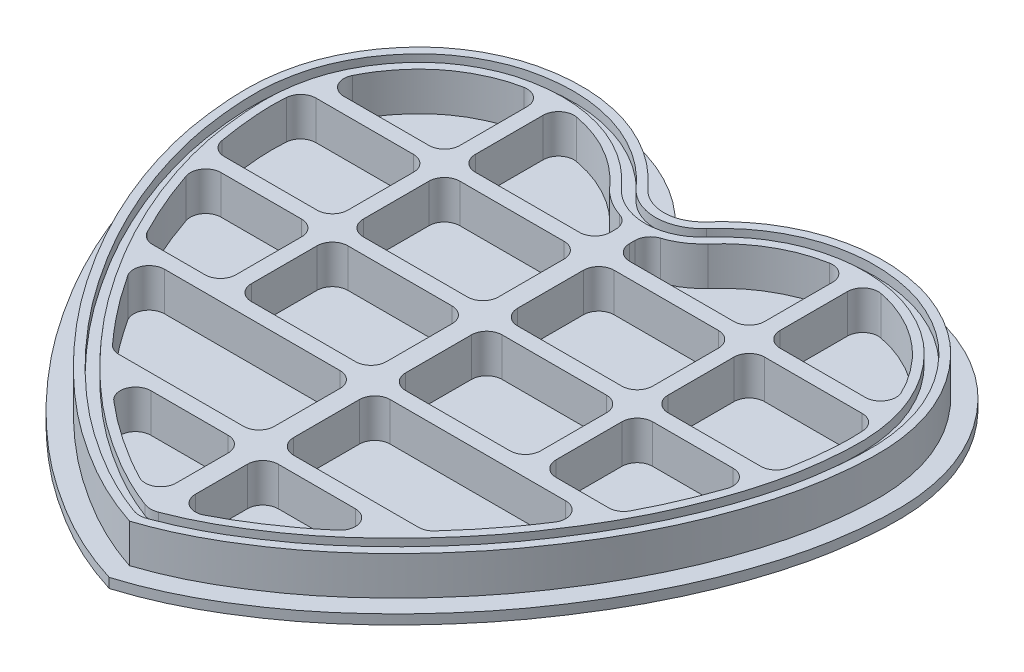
SolidWorks part; units mm, degrees
ref_plane "Front Plane" through (0, 0, 0) normal (0, 0, 1) x (1, 0, 0)
ref_plane "Top Plane" through (0, 0, 0) normal (0, 1, 0) x (1, 0, 0)
ref_plane "Right Plane" through (0, 0, 0) normal (1, 0, 0) x (0, 0, -1)
sketch "Sketch1" plane through (0, 0, 0) normal (0, 1, 0) x (1, 0, 0)
  arc A0 (-4.7475, 190.8725) -> (4.7475, 190.8725) centre (0, 195.0896) ccw
  spline S0 degree 3 poles (0, 0) (-6.9704, 2.1411) (-17.3052, 6.5092) (-30.2851, 14.3663) (-40.1508, 21.1835) (-49.6034, 29.0743) (-58.743, 37.7359) (-67.3785, 47.1382) (-75.5752, 57.1133) (-82.955, 67.7484) (-89.7919, 78.7217) (-95.738, 90.1158) (-100.8249, 101.7554) (-104.934, 113.6029) (-108.0334, 125.5149) (-109.7563, 137.4697) (-110.4471, 147.5565) (-110.0632, 155.7161) (-109.1075, 161.8984) (-107.688, 167.8632) (-105.6136, 173.5598) (-103.0387, 178.9712) (-99.994, 184.084) (-96.4904, 188.8114) (-92.6277, 193.2321) (-88.3533, 197.2568) (-83.6456, 200.8156) (-78.6368, 203.9332) (-73.2922, 206.5079) (-67.7257, 208.658) (-61.8582, 210.0699) (-55.8523, 211.0164) (-49.2375, 211.3688) (-42.1783, 210.9497) (-34.8451, 209.5327) (-27.8211, 207.308) (-21.2163, 204.1683) (-15.0288, 200.3457) (-9.5539, 195.8446) (-6.2412, 192.5542) (-4.7475, 190.8725) knots 0 0 0 0 0.062261 0.09531 0.129472 0.164592 0.200365 0.236953 0.273568 0.310548 0.347436 0.383933 0.420222 0.455837 0.490947 0.525167 0.558872 0.577133 0.594814 0.612233 0.62942 0.646491 0.663354 0.680162 0.696681 0.71344 0.73021 0.74701 0.763743 0.780818 0.797872 0.815181 0.832691 0.854352 0.875406 0.896334 0.917108 0.937714 0.958297 0.977512 0.977512 0.977512 0.977512
  spline S1 degree 3 poles (0, 0) (6.9704, 2.1411) (17.3052, 6.5092) (30.2851, 14.3663) (40.1508, 21.1835) (49.6034, 29.0743) (58.743, 37.7359) (67.3785, 47.1382) (75.5752, 57.1133) (82.955, 67.7484) (89.7919, 78.7217) (95.738, 90.1158) (100.8249, 101.7554) (104.934, 113.6029) (108.0334, 125.5149) (109.7563, 137.4697) (110.4471, 147.5565) (110.0632, 155.7161) (109.1075, 161.8984) (107.688, 167.8632) (105.6136, 173.5598) (103.0387, 178.9712) (99.994, 184.084) (96.4904, 188.8114) (92.6277, 193.2321) (88.3533, 197.2568) (83.6456, 200.8156) (78.6368, 203.9332) (73.2922, 206.5079) (67.7257, 208.658) (61.8582, 210.0699) (55.8523, 211.0164) (49.2375, 211.3688) (42.1783, 210.9497) (34.8451, 209.5327) (27.8211, 207.308) (21.2163, 204.1683) (15.0288, 200.3457) (9.5539, 195.8446) (6.2412, 192.5542) (4.7475, 190.8725) knots 0 0 0 0 0.062261 0.09531 0.129472 0.164592 0.200365 0.236953 0.273568 0.310548 0.347436 0.383933 0.420222 0.455837 0.490947 0.525167 0.558872 0.577133 0.594814 0.612233 0.62942 0.646491 0.663354 0.680162 0.696681 0.71344 0.73021 0.74701 0.763743 0.780818 0.797872 0.815181 0.832691 0.854352 0.875406 0.896334 0.917108 0.937714 0.958297 0.977512 0.977512 0.977512 0.977512
  dimension "D1" = 6.35
extrude "Boss-Extrude1" add sketch "Sketch1" along normal blind 3.175
sketch "Sketch4" plane through (0, 3.175, 0) normal (0, 1, 0) x (1, 0, 0)
  arc A1 (-9.495, 186.6555) -> (9.495, 186.6555) centre (0, 195.0896) ccw
  arc A2 (-9.495, 186.6555) -> (9.495, 186.6555) centre (0, 195.0896) ccw
  spline S4 degree 3 number of poles 122 (-9.495, 186.6555) -> (0, 6.6626)
  spline S5 degree 3 number of poles 124 (0, 6.6626) -> (9.495, 186.6555)
  spline S6 degree 3 number of poles 122 (-9.495, 186.6555) -> (0, 6.6626)
  spline S7 degree 3 number of poles 124 (0, 6.6626) -> (9.495, 186.6555)
  dimension "D1" = 6.35
extrude "Boss-Extrude3" add sketch "Sketch4" along normal blind 12.7
sketch "Sketch5" plane through (0, 15.875, 0) normal (0, 1, 0) x (1, 0, 0)
  line L1 (-3.175, 162.9059) -> (-3.175, 173.7344)
  line L2 (3.175, 162.9059) -> (3.175, 173.7344)
  line L3 (-93.1372, 162.9059) -> (-52.6696, 162.9059)
  line L4 (52.6696, 162.9059) -> (93.137, 162.9059)
  line L5 (-94.2805, 157.8259) -> (-52.6696, 157.8259)
  line L6 (3.175, 162.9059) -> (47.5896, 162.9059)
  line L7 (-92.3343, 126.0759) -> (-52.6696, 126.0759)
  line L8 (-47.5896, 162.9059) -> (-3.175, 162.9059)
  line L9 (-141.8606, 126.0759) -> (144.7018, 126.0759)
  line L10 (-141.8606, 157.8259) -> (144.7018, 157.8259)
  line L13 (-141.8606, 89.2459) -> (144.7018, 89.2459)
  line L14 (-141.8606, 120.9959) -> (144.7018, 120.9959)
  line L17 (-141.8606, 52.4159) -> (144.7018, 52.4159)
  line L18 (-141.8606, 84.1659) -> (144.7018, 84.1659)
  line L21 (-141.8606, 15.5859) -> (144.7018, 15.5859)
  line L22 (-141.8606, 47.3359) -> (144.7018, 47.3359)
  line L24 (-3.175, 17.2878) -> (-3.175, 47.3359)
  line L25 (-78.0235, 89.2459) -> (-52.6696, 89.2459)
  line L26 (-91.0427, 120.9959) -> (-52.6696, 120.9959)
  line L27 (3.175, 157.8259) -> (47.5896, 157.8259)
  line L28 (3.175, 17.2878) -> (3.175, 47.3359)
  line L29 (-51.4861, 52.4159) -> (-3.175, 52.4159)
  line L30 (-75.137, 84.1659) -> (-3.175, 84.1659)
  line L31 (-52.6696, 236.659) -> (-47.5896, 236.659)
  line L32 (3.175, 84.1659) -> (75.137, 84.1659)
  line L33 (3.175, 126.0759) -> (3.175, 157.8259)
  line L34 (-46.5896, 47.3359) -> (-3.175, 47.3359)
  line L35 (-3.175, 89.2459) -> (-3.175, 120.9959)
  line L37 (-8.843, 15.5859) -> (8.8433, 15.5859)
  line L38 (-52.6696, 195.8923) -> (-52.6696, 162.9059)
  line L39 (-3.175, 126.0759) -> (-3.175, 157.8259)
  line L40 (3.175, 126.0759) -> (47.5896, 126.0759)
  line L41 (3.175, 120.9959) -> (47.5896, 120.9959)
  line L42 (3.175, 89.2459) -> (47.5896, 89.2459)
  line L43 (3.175, 89.2459) -> (3.175, 120.9959)
  line L44 (3.175, 52.4159) -> (51.4862, 52.4159)
  line L45 (3.175, 47.3359) -> (46.5896, 47.3359)
  line L46 (-3.175, 52.4159) -> (-3.175, 84.1659)
  line L47 (3.175, 52.4159) -> (3.175, 84.1659)
  line L48 (52.6696, 157.8259) -> (94.2806, 157.8259)
  line L49 (-47.5896, 195.9577) -> (-47.5896, 162.9059)
  line L50 (-47.5896, 126.0759) -> (-3.175, 126.0759)
  line L52 (-52.6696, 120.9959) -> (-52.6696, 89.2459)
  line L53 (-47.5896, 120.9959) -> (-47.5896, 89.2459)
  line L54 (52.6696, 126.0759) -> (92.3343, 126.0759)
  line L55 (-47.5896, 157.8259) -> (-3.175, 157.8259)
  line L56 (-47.5896, 157.8259) -> (-47.5896, 126.0759)
  line L57 (-52.6696, 157.8259) -> (-52.6696, 126.0759)
  line L58 (-47.5896, 120.9959) -> (-3.175, 120.9959)
  line L59 (-47.5896, 89.2459) -> (-3.175, 89.2459)
  line L60 (47.5896, 195.9577) -> (47.5896, 126.0759)
  line L62 (52.6696, 195.8924) -> (52.6696, 126.0759)
  line L63 (52.6696, 120.9959) -> (91.0427, 120.9959)
  line L66 (47.5896, 120.9959) -> (47.5896, 89.2459)
  line L67 (52.6696, 120.9959) -> (52.6696, 89.2459)
  line L68 (52.6696, 89.2459) -> (78.0235, 89.2459)
  arc A1 (3.175, 173.7344) -> (16.1414, 180.7515) centre (0, 195.0896) ccw
  arc A6 (-16.1414, 180.7515) -> (16.1414, 180.7515) centre (0, 195.0896) ccw
  arc A7 (-16.1414, 180.7515) -> (-3.175, 173.7344) centre (0, 195.0896) ccw
  spline S0 degree 3 poles (47.5896, 195.9577) (47.4876, 195.9532) (47.3856, 195.9484) (46.5397, 195.9059) (45.7926, 195.8493) (44.3115, 195.6978) (43.5761, 195.6024) (41.3849, 195.2613) (39.9436, 194.961) (37.0959, 194.2297) (35.6892, 193.7996) (33.611, 193.0359) (32.9238, 192.7608) (31.5601, 192.1702) (30.8819, 191.8543) (28.8739, 190.8589) (27.5742, 190.1394) (25.6855, 188.973) (25.0664, 188.5692) (23.8519, 187.7276) (23.2569, 187.2892) (21.5048, 185.9269) (20.3789, 184.9583) (18.1913, 182.929) (17.1344, 181.8693) (16.1414, 180.7515) knots 0.873928 0.873928 0.873928 0.873928 0.875 0.875 0.882812 0.882812 0.890625 0.890625 0.90625 0.90625 0.921875 0.921875 0.929687 0.929687 0.9375 0.9375 0.953125 0.953125 0.960937 0.960937 0.96875 0.96875 0.984375 0.984375 1 1 1 1
  spline S1 degree 3 poles (93.137, 162.9059) (93.0147, 163.3366) (92.8856, 163.7639) (92.5235, 164.8889) (92.2788, 165.5808) (91.4957, 167.6324) (90.9106, 168.9692) (89.625, 171.5861) (88.9248, 172.8663) (87.3985, 175.3649) (86.5683, 176.5813) (85.2315, 178.3609) (84.7735, 178.9447) (83.8387, 180.0894) (83.3609, 180.6508) (81.8939, 182.3001) (80.8705, 183.3521) (78.7152, 185.3425) (77.581, 186.2786) (75.2083, 188.0416) (73.9688, 188.8772) (72.0724, 190.0241) (71.4324, 190.3887) (70.136, 191.0801) (69.4798, 191.4079) (68.1545, 192.0339) (67.4855, 192.3325) (66.1364, 192.9045) (65.4559, 193.1771) (64.0783, 193.6844) (63.3808, 193.9181) (61.9637, 194.3357) (61.2448, 194.5212) (59.7924, 194.8586) (59.0626, 195.0102) (57.6029, 195.2858) (56.8719, 195.4095) (54.9864, 195.6854) (53.8298, 195.8117) (52.6696, 195.8924) knots 0.659341 0.659341 0.659341 0.659341 0.664062 0.664062 0.671875 0.671875 0.6875 0.6875 0.703125 0.703125 0.71875 0.71875 0.726562 0.726562 0.734375 0.734375 0.75 0.75 0.765625 0.765625 0.78125 0.78125 0.789062 0.789062 0.796875 0.796875 0.804687 0.804687 0.8125 0.8125 0.820312 0.820312 0.828125 0.828125 0.835937 0.835937 0.84375 0.84375 0.856053 0.856053 0.856053 0.856053
  spline S3 degree 3 poles (51.4862, 52.4159) (53.037, 54.0896) (54.558, 55.792) (57.9625, 59.7266) (59.8302, 61.9741) (62.5419, 65.4315) (63.4303, 66.5987) (65.1754, 68.9638) (66.0325, 70.1611) (67.721, 72.5803) (68.5519, 73.8016) (70.1859, 76.2535) (70.9904, 77.4853) (72.9319, 80.5225) (74.0526, 82.3356) (75.137, 84.1659) knots 0.225541 0.225541 0.225541 0.225541 0.25 0.25 0.28125 0.28125 0.296875 0.296875 0.3125 0.3125 0.328125 0.328125 0.34375 0.34375 0.366455 0.366455 0.366455 0.366455
  spline S4 degree 3 poles (-75.137, 84.1659) (-74.0404, 82.3151) (-72.9069, 80.4821) (-70.9511, 77.4248) (-70.1456, 76.1924) (-68.5099, 73.7394) (-67.6786, 72.5185) (-65.1479, 68.8962) (-63.4066, 66.5321) (-59.7922, 61.9275) (-57.9247, 59.6816) (-54.5325, 55.7636) (-53.0242, 54.0758) (-51.4861, 52.4159) knots 0.633313 0.633313 0.633313 0.633313 0.65625 0.65625 0.671875 0.671875 0.6875 0.6875 0.71875 0.71875 0.75 0.75 0.774254 0.774254 0.774254 0.774254
  spline S5 degree 3 poles (-46.5896, 47.3359) (-45.7271, 46.4767) (-44.8553, 45.6263) (-41.8618, 42.7686) (-39.6973, 40.8013) (-35.2601, 36.9682) (-32.9822, 35.1054) (-28.271, 31.5334) (-25.8603, 29.845) (-22.1874, 27.4132) (-20.9542, 26.6183) (-18.4681, 25.0637) (-17.2146, 24.3048) (-14.6812, 22.8339) (-13.4011, 22.1222) (-10.8085, 20.7561) (-9.4965, 20.101) (-6.5289, 18.7013) (-4.8648, 17.9717) (-3.175, 17.2878) knots 0.79946 0.79946 0.79946 0.79946 0.8125 0.8125 0.84375 0.84375 0.875 0.875 0.90625 0.90625 0.921875 0.921875 0.9375 0.9375 0.953125 0.953125 0.96875 0.96875 0.988036 0.988036 0.988036 0.988036
  spline S6 degree 3 poles (78.0235, 89.2459) (78.8709, 90.8037) (79.6912, 92.3744) (81.7938, 96.5641) (83.0343, 99.203) (86.5406, 107.2219) (88.5802, 112.7093) (90.542, 119.2338) (90.797, 120.1127) (91.0427, 120.9959) knots 0.387272 0.387272 0.387272 0.387272 0.40625 0.40625 0.4375 0.4375 0.5 0.5 0.50968 0.50968 0.50968 0.50968
  spline S7 degree 3 poles (-91.0427, 120.9959) (-90.7976, 120.1152) (-90.5427, 119.2363) (-88.5765, 112.6964) (-86.5312, 107.1972) (-83.0167, 99.1644) (-81.7735, 96.5216) (-79.6752, 92.3438) (-78.8626, 90.7885) (-78.0235, 89.2459) knots 0.490345 0.490345 0.490345 0.490345 0.5 0.5 0.5625 0.5625 0.59375 0.59375 0.612518 0.612518 0.612518 0.612518
  spline S8 degree 3 poles (92.3343, 126.0759) (92.4008, 126.3663) (92.466, 126.657) (93.1646, 129.8372) (93.6589, 132.7486) (94.2407, 137.1407) (94.4096, 138.6086) (94.7006, 141.5518) (94.8216, 143.0281) (94.991, 145.9887) (95.0388, 147.4658) (95.0349, 150.4117) (94.9831, 151.8805) (94.7439, 154.8065) (94.5519, 156.2634) (94.2935, 157.752) (94.287, 157.789) (94.2806, 157.8259) knots 0.528104 0.528104 0.528104 0.528104 0.53125 0.53125 0.5625 0.5625 0.578125 0.578125 0.59375 0.59375 0.609375 0.609375 0.625 0.625 0.640625 0.640625 0.641022 0.641022 0.641022 0.641022
  spline S10 degree 3 poles (-52.6696, 195.8923) (-53.8064, 195.8133) (-54.9414, 195.6903) (-56.8083, 195.4198) (-57.5414, 195.2966) (-59.0063, 195.0216) (-59.7378, 194.8703) (-61.1847, 194.5362) (-61.9015, 194.3524) (-63.3165, 193.9386) (-64.014, 193.7066) (-65.3926, 193.2017) (-66.0742, 192.9299) (-67.4262, 192.3585) (-68.097, 192.06) (-69.427, 191.4337) (-70.086, 191.1057) (-71.3894, 190.4127) (-72.0333, 190.0469) (-73.3065, 189.2786) (-73.9361, 188.8767) (-75.1684, 188.0488) (-75.7728, 187.6215) (-77.5521, 186.3014) (-78.6889, 185.3654) (-80.8533, 183.3694) (-81.8833, 182.3123) (-83.361, 180.6504) (-83.8431, 180.0832) (-84.7851, 178.9297) (-85.2435, 178.3455) (-86.5772, 176.5683) (-87.4089, 175.3495) (-88.9428, 172.8352) (-89.649, 171.5421) (-90.623, 169.5519) (-90.9332, 168.8799) (-91.5239, 167.5184) (-91.8054, 166.8271) (-92.3314, 165.4354) (-92.5756, 164.7358) (-92.9177, 163.6578) (-93.0302, 163.2824) (-93.1372, 162.9059) knots 0.144186 0.144186 0.144186 0.144186 0.15625 0.15625 0.164062 0.164062 0.171875 0.171875 0.179687 0.179687 0.1875 0.1875 0.195312 0.195312 0.203125 0.203125 0.210937 0.210937 0.21875 0.21875 0.226562 0.226562 0.234375 0.234375 0.25 0.25 0.265625 0.265625 0.273437 0.273437 0.28125 0.28125 0.296875 0.296875 0.3125 0.3125 0.320313 0.320313 0.328125 0.328125 0.335938 0.335938 0.340092 0.340092 0.340092 0.340092
  spline S14 degree 3 poles (-94.2805, 157.8259) (-94.2937, 157.751) (-94.3067, 157.6762) (-94.5676, 156.1545) (-94.7574, 154.6961) (-94.9901, 151.7501) (-95.0386, 150.2585) (-95.0361, 147.2985) (-94.9847, 145.8255) (-94.8111, 142.8893) (-94.6894, 141.4261) (-94.3982, 138.5064) (-94.2296, 137.0498) (-93.6492, 132.6902) (-93.1568, 129.7987) (-92.4628, 126.6428) (-92.3992, 126.3592) (-92.3343, 126.0759) knots 0.358566 0.358566 0.358566 0.358566 0.359375 0.359375 0.375 0.375 0.390625 0.390625 0.40625 0.40625 0.421875 0.421875 0.4375 0.4375 0.46875 0.46875 0.471837 0.471837 0.471837 0.471837
  spline S18 degree 3 poles (3.175, 17.2878) (4.8687, 17.9733) (6.5369, 18.7048) (9.5115, 20.1083) (10.8263, 20.7652) (13.4247, 22.1351) (14.7079, 22.849) (17.2479, 24.3246) (18.5048, 25.0862) (20.9981, 26.6463) (22.2351, 27.444) (24.6911, 29.0717) (25.9097, 29.9027) (28.3238, 31.6062) (29.5211, 32.4798) (33.047, 35.1567) (35.3181, 37.0174) (39.7484, 40.8461) (41.9093, 42.8125) (44.8849, 45.6552) (45.7418, 46.4912) (46.5896, 47.3359) knots 0.011949 0.011949 0.011949 0.011949 0.03125 0.03125 0.046875 0.046875 0.0625 0.0625 0.078125 0.078125 0.09375 0.09375 0.109375 0.109375 0.125 0.125 0.15625 0.15625 0.1875 0.1875 0.200327 0.200327 0.200327 0.200327
  spline S19 degree 3 poles (-16.1414, 180.7515) (-17.1349, 181.8699) (-18.1822, 182.9194) (-20.3465, 184.9293) (-21.4624, 185.8912) (-23.203, 187.2486) (-23.7947, 187.6863) (-25.0047, 188.5279) (-25.6224, 188.9325) (-26.8807, 189.7122) (-27.5213, 190.0875) (-28.8233, 190.8114) (-29.4864, 191.1613) (-31.4896, 192.158) (-32.8468, 192.7518) (-35.6124, 193.7744) (-37.0192, 194.2076) (-39.8727, 194.9452) (-41.3195, 195.249) (-43.5234, 195.5954) (-44.2662, 195.6923) (-45.7498, 195.8456) (-46.4908, 195.9025) (-47.3505, 195.9468) (-47.4701, 195.9525) (-47.5896, 195.9577) knots 0 0 0 0 0.015625 0.015625 0.03125 0.03125 0.039063 0.039063 0.046875 0.046875 0.054688 0.054688 0.0625 0.0625 0.078125 0.078125 0.09375 0.09375 0.109375 0.109375 0.117187 0.117187 0.125 0.125 0.126262 0.126262 0.126262 0.126262
  point P2 (-50.1296, 162.9059)
  point P7 (0, 102.3991)
  point P9 (50.1296, 162.9059)
  dimension "D2" = 5.08
  dimension "D3" = 31.75
  dimension "D6" = 6.35
  dimension "D1" = 5.08
  dimension "D7" = 5.08
  dimension "D9" = 8.89
  dimension "D4" = 2
  dimension "D5" = 4
extrude "Cut-Extrude1" cut sketch "Sketch5" against normal blind 12.7
fillet "Fillet1" radius 5.08 60 edges at (-52.6696, 9.525, -89.2459) (-52.6696, 9.525, -120.9959) (-52.6696, 9.525, -157.8259) (-52.6696, 9.525, -126.0759) (-3.175, 9.525, -157.8259) (-47.5896, 9.525, -157.8259) (-3.175, 9.525, -126.0759) (-47.5896, 9.525, -126.0759) (-3.175, 9.525, -120.9959) (-47.5896, 9.525, -120.9959) (-47.5896, 9.525, -89.2459) (-3.175, 9.525, -89.2459) (3.175, 9.525, -47.3359) (-3.175, 9.525, -47.3359) (-3.175, 9.525, -84.1659) (-3.175, 9.525, -52.4159) (3.175, 9.525, -84.1659) (3.175, 9.525, -52.4159) (52.6696, 9.525, -120.9959) (52.6696, 9.525, -89.2459) (47.5896, 9.525, -120.9959) (47.5896, 9.525, -89.2459) (3.175, 9.525, -89.2459) (3.175, 9.525, -120.9959) (47.5896, 9.525, -126.0759) (3.175, 9.525, -126.0759) (3.175, 9.525, -157.8259) (47.5896, 9.525, -157.8259) (52.6696, 9.525, -126.0759) (52.6696, 9.525, -157.8259) (52.6696, 9.525, -162.9059) (47.5896, 9.525, -162.9059) (3.175, 9.525, -162.9059) (-3.175, 9.525, -162.9059) (-52.6696, 9.525, -162.9059) (-47.5896, 9.525, -162.9059) (-3.175, 9.525, -173.7344) (3.175, 9.525, -173.7344)
sketch "Sketch7" plane through (0, 15.875, 0) normal (0, 1, 0) x (1, 0, 0)
  arc A1 (-14.1, 182.5649) -> (14.1, 182.5649) centre (0, 195.0896) ccw
  arc A2 (-11.5364, 184.8421) -> (11.5364, 184.8421) centre (0, 195.0896) ccw
  arc A3 (-11.5364, 184.8421) -> (11.5364, 184.8421) centre (0, 195.0896) ccw
  spline S2 degree 1 poles (-14.1, 182.5649) (0, 13.1685) knots 0 0 1 1 construction
  spline S3 degree 1 poles (0, 13.1685) (14.1, 182.5649) knots 0 0 1 1 construction
  spline S4 degree 3 number of poles 126 (0, 9.5409) -> (11.5364, 184.8421)
  spline S5 degree 3 number of poles 118 (-11.5364, 184.8421) -> (0, 9.5409)
  spline S6 degree 3 number of poles 126 (0, 9.5409) -> (11.5364, 184.8421)
  spline S7 degree 3 number of poles 118 (-11.5364, 184.8421) -> (0, 9.5409)
  spline S8 degree 3 poles (-14.1, 182.5649) (-15.0977, 183.688) (-17.2117, 185.82) (-20.6389, 188.8) (-24.208, 191.3499) (-28.1543, 193.6127) (-32.2502, 195.5148) (-37.8495, 197.4023) (-43.776, 198.5536) (-49.7839, 198.7981) (-54.2469, 198.5721) (-57.9665, 198.0231) (-60.9751, 197.4038) (-63.1377, 196.8588) (-65.1975, 196.1997) (-67.2654, 195.4038) (-69.34, 194.5059) (-71.3557, 193.5362) (-73.3005, 192.4817) (-75.8618, 190.9195) (-78.949, 188.7382) (-82.2876, 185.852) (-85.3582, 182.6002) (-88.2346, 179.0126) (-90.7097, 175.314) (-92.8418, 171.3746) (-94.3429, 167.9308) (-95.3443, 165.103) (-96.1721, 162.2837) (-96.9727, 158.5877) (-97.6035, 154.1717) (-97.888, 148.1346) (-97.4362, 140.4332) (-96.2717, 131.1991) (-94.3307, 122.2272) (-91.6067, 113.2061) (-88.363, 104.4629) (-84.5919, 95.9555) (-80.3791, 87.6663) (-75.6758, 79.6462) (-70.5317, 71.747) (-65.0799, 64.0999) (-59.1976, 56.8881) (-52.9917, 49.9118) (-46.4955, 43.3063) (-39.6223, 37.0213) (-32.4583, 31.1296) (-24.7635, 25.7479) (-16.8129, 20.7747) (-8.6546, 16.5292) (-2.9113, 14.1932) (0, 13.1685) knots 0 0 0 0 0.015564 0.031129 0.046693 0.062257 0.077821 0.093386 0.124514 0.140078 0.155643 0.171207 0.178989 0.186771 0.194553 0.202336 0.210118 0.2179 0.225682 0.233464 0.249028 0.264593 0.280157 0.295721 0.311285 0.32685 0.342414 0.350196 0.357978 0.373543 0.389107 0.404671 0.4358 0.466928 0.498057 0.529185 0.560314 0.591442 0.622571 0.6537 0.684828 0.715957 0.747085 0.778214 0.809342 0.840471 0.871599 0.902728 0.933856 0.964985 0.996114 0.996114 0.996114 0.996114
  spline S9 degree 3 poles (0, 13.1685) (2.9147, 14.1944) (8.6648, 16.5336) (16.8311, 20.785) (24.7883, 25.7641) (32.4912, 31.1537) (39.6663, 37.0594) (46.5498, 43.358) (53.0559, 49.9806) (59.2721, 56.9746) (65.1632, 64.208) (70.6175, 71.8742) (75.7556, 79.7738) (80.4512, 87.7989) (84.6566, 96.0915) (88.4195, 104.6018) (91.6524, 113.3418) (94.3706, 122.3789) (95.9912, 129.9083) (96.8757, 136.0576) (97.5599, 142.2854) (97.8899, 148.4666) (97.5783, 154.419) (96.9237, 158.857) (95.9338, 163.3336) (94.5423, 167.5005) (92.7298, 171.6017) (89.8608, 176.8455) (86.2291, 181.6963) (82.135, 186) (78.7451, 188.8962) (75.0328, 191.491) (71.2204, 193.6644) (67.7657, 195.218) (64.9829, 196.2773) (62.8946, 196.9262) (60.7383, 197.4563) (57.7767, 198.0549) (54.0979, 198.5861) (49.6316, 198.7992) (45.126, 198.5989) (40.7554, 197.9645) (36.4058, 196.9192) (32.1716, 195.483) (28.1381, 193.6013) (24.2457, 191.3726) (20.6691, 188.826) (17.1992, 185.809) (15.0969, 183.6872) (14.1, 182.5649) knots 0.003882 0.003882 0.003882 0.003882 0.03501 0.066139 0.097268 0.128396 0.159525 0.190654 0.221783 0.252911 0.28404 0.315169 0.346297 0.377426 0.408555 0.439683 0.470812 0.501941 0.53307 0.548634 0.564198 0.595327 0.610891 0.626456 0.64202 0.657584 0.673149 0.688713 0.719842 0.735406 0.75097 0.766535 0.782099 0.797663 0.805446 0.813228 0.82101 0.828792 0.844357 0.859921 0.875485 0.89105 0.906614 0.922178 0.937743 0.953307 0.968871 0.984436 1 1 1 1
  dimension "D1" = 2.7305
  dimension "D2" = 3.429
extrude "Cut-Extrude2" cut sketch "Sketch7" against normal blind 3.175
fillet "Fillet2" radius 6.35 2 edges at (0, 14.2875, -13.1685)
